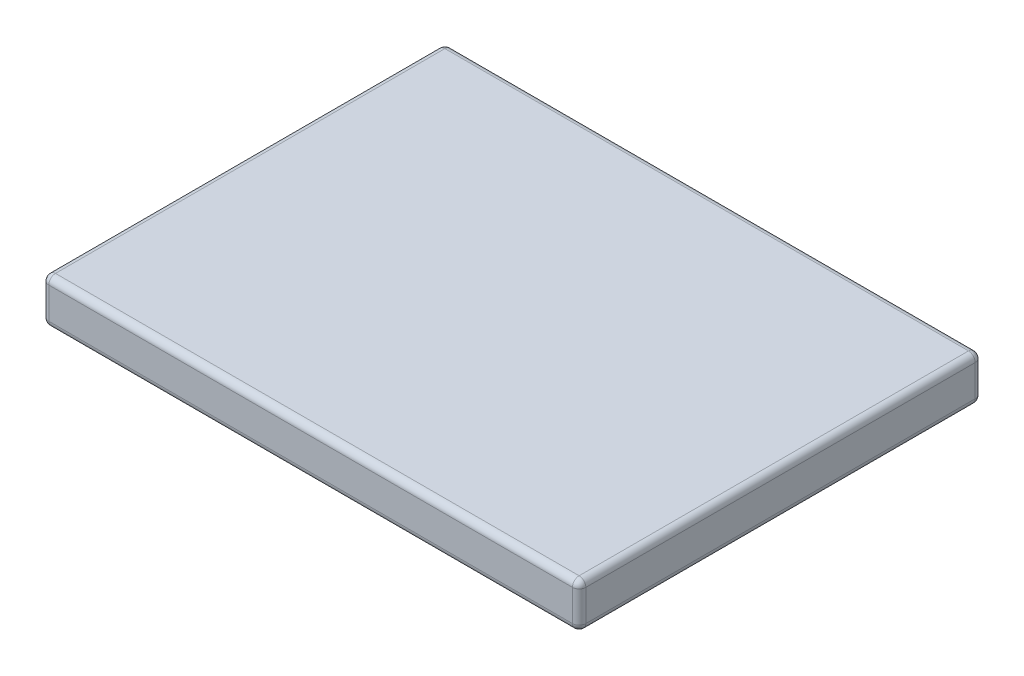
SolidWorks part; units mm, degrees
ref_plane "Front Plane" through (0, 0, 0) normal (0, 0, 1) x (1, 0, 0)
ref_plane "Top Plane" through (0, 0, 0) normal (0, 1, 0) x (1, 0, 0)
ref_plane "Right Plane" through (0, 0, 0) normal (1, 0, 0) x (0, 0, -1)
sketch "Sketch1" plane through (0, 0, 0) normal (0, 1, 0) x (1, 0, 0)
  line L0 (-304.8, -228.6) -> (304.8, 228.6) construction
  line L1 (-304.8, 228.6) -> (304.8, 228.6)
  line L2 (-304.8, 228.6) -> (-304.8, -228.6)
  line L3 (-304.8, -228.6) -> (304.8, -228.6)
  line L4 (304.8, 228.6) -> (304.8, -228.6)
  dimension "D1" = 457.2
  dimension "D2" = 609.6
extrude "Extrude1" add sketch "Sketch1" along normal blind 50.8
fillet "Fillet1" radius 7.62 12 edges at (-304.8, 0, 0) (0, 0, 228.6) (304.8, 0, 0) (0, 0, -228.6) (-304.8, 50.8, 0) (0, 50.8, 228.6) (304.8, 50.8, 0) (0, 50.8, -228.6) (-304.8, 25.4, -228.6) (304.8, 25.4, -228.6) (304.8, 25.4, 228.6) (-304.8, 25.4, 228.6)
